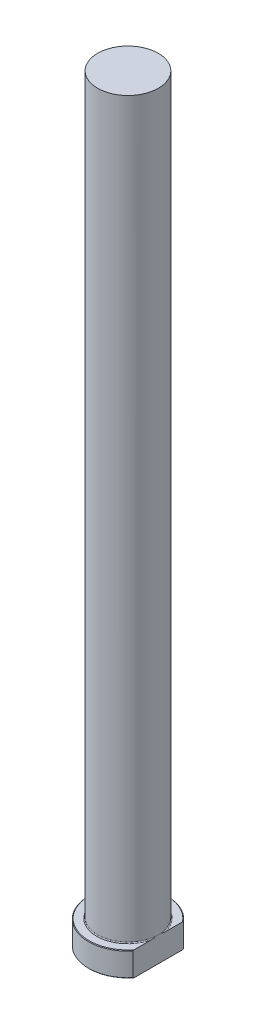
SolidWorks part; units mm, degrees
ref_plane "Front Plane" through (0, 0, 0) normal (0, 0, 1) x (1, 0, 0)
ref_plane "Top Plane" through (0, 0, 0) normal (0, 1, 0) x (1, 0, 0)
ref_plane "Right Plane" through (0, 0, 0) normal (1, 0, 0) x (0, 0, -1)
sketch "Sketch1" plane through (0, 0, 0) normal (0, 0, 1) x (1, 0, 0)
  line L0 (0, 259.9588) -> (0, -15.1925) construction
  line L1 (0, 0) -> (-13, 0)
  line L2 (-13, 0) -> (-13, 8)
  line L3 (-13, 8) -> (-10, 8)
  line L4 (-10, 8) -> (-10, 250)
  line L5 (-10, 250) -> (0, 250)
  line L6 (0, 250) -> (0, 0)
  dimension "L" = 250
  dimension "H" = 26
  dimension "T" = 8
  dimension "D" = 20
revolve "Revolve1" add sketch "Sketch1" angle 360 about L0
chamfer "Chamfer1" distance 0.2 angle 45 2 edges at (0, 8, 13) (0, 0, 13)
fillet "Fillet1" radius 0.3 1 edges at (0, 8, 10)
sketch "Sketch2" plane through (0, 0, 0) normal (0, 1, 0) x (1, 0, 0)
  line L0 (10, 8.3066) -> (10, -8.3066)
  circle A0 centre (0, 0) radius 13 construction
  arc A1 (10, -8.3066) -> (10, 8.3066) centre (0, 0) ccw
  circle A2 centre (0, 0) radius 10 construction
extrude "KEY" cut sketch "Sketch2" along normal through all
